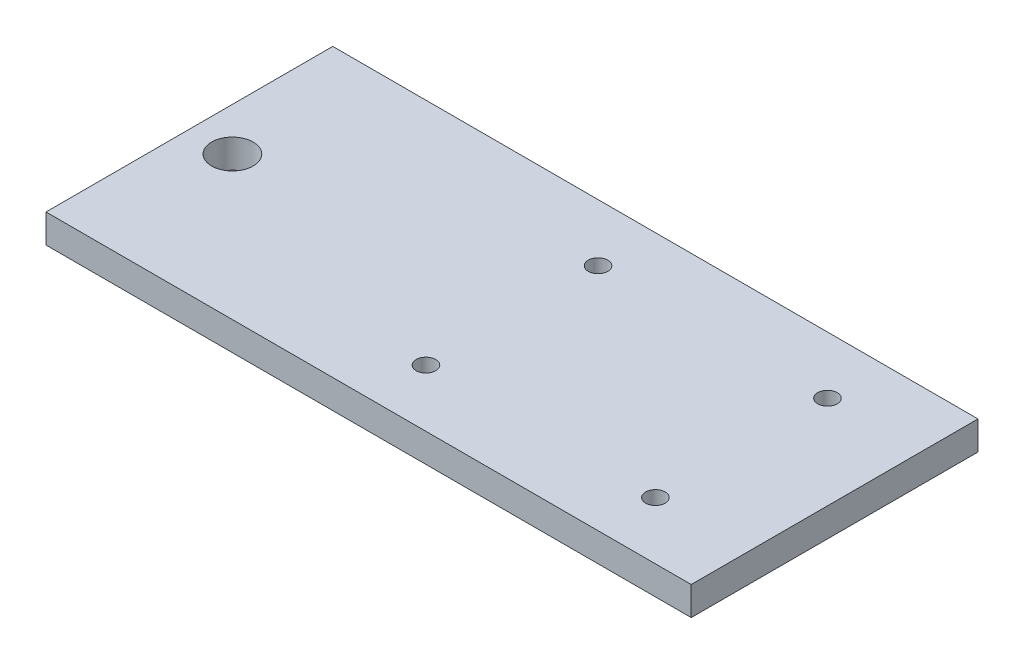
SolidWorks part; units mm, degrees
ref_plane "Plan de face" through (0, 0, 0) normal (0, 0, 1) x (1, 0, 0)
ref_plane "Plan de dessus" through (0, 0, 0) normal (0, 1, 0) x (1, 0, 0)
ref_plane "Plan de droite" through (0, 0, 0) normal (1, 0, 0) x (0, 0, -1)
sketch "Esquisse1" plane through (0, 0, 0) normal (1, 0, 0) x (0, 0, -1)
  line L1 (-50, 0) -> (50, 0)
  line L2 (-50, 0) -> (-50, -10)
  line L3 (-50, -10) -> (50, -10)
  line L4 (50, 0) -> (50, -10)
  dimension "D1" = 100
  dimension "D2" = 10
extrude "Extrusion1" add sketch "Esquisse1" along normal mid plane 225
sketch "Esquisse2" plane through (0, 0, 0) normal (0, 1, 0) x (-1, 0, 0)
  line L0 (-112.5, 50) -> (112.5, 50) construction
  line L1 (-112.5, -50) -> (-112.5, 50) construction
  circle A0 centre (97.5, 0) radius 7.25
  dimension "D1" = 14.5
  dimension "D2" = 50
  dimension "D3" = 210
extrude "Enlèv. mat.-Extru.1" cut sketch "Esquisse2" against normal blind 210
hole_wizard "Trou taraudé M8x1.251" positions "Esquisse4" profile "Esquisse3" tap size "M8x1.25" standard "DIN"
sketch "Esquisse4" plane through (0, 0, 0) normal (0, 1, 0) x (-1, 0, 0)
  line L0 (-112.5, -50) -> (-112.5, 50) construction
  line L1 (-112.5, -50) -> (112.5, -50) construction
  point P0 (0, 30)
  point P1 (0, -30)
  point P2 (-80, -30)
  point P3 (-80, 30)
  dimension "D1" = 32.5
  dimension "D2" = 80
  dimension "D3" = 20
  dimension "D4" = 60
sketch "Esquisse3" plane through (0, 0, 30) normal (1, 0, 0) x (0, 0, 1)
  line L0 (0, 0) -> (0, 10)
  line L1 (0, 10) -> (3.4, 10)
  line L2 (3.4, 10) -> (3.4, 0)
  line L5 (3.4, 0) -> (0, 0)
  line L11 (0, -6.35) -> (0, 107.95) construction
  dimension "Diamètre du trou pour taraudage jusqu'au prochain" = 6.8
  dimension "Profondeur du trou pour taraudage jusqu'au prochain" = 10
